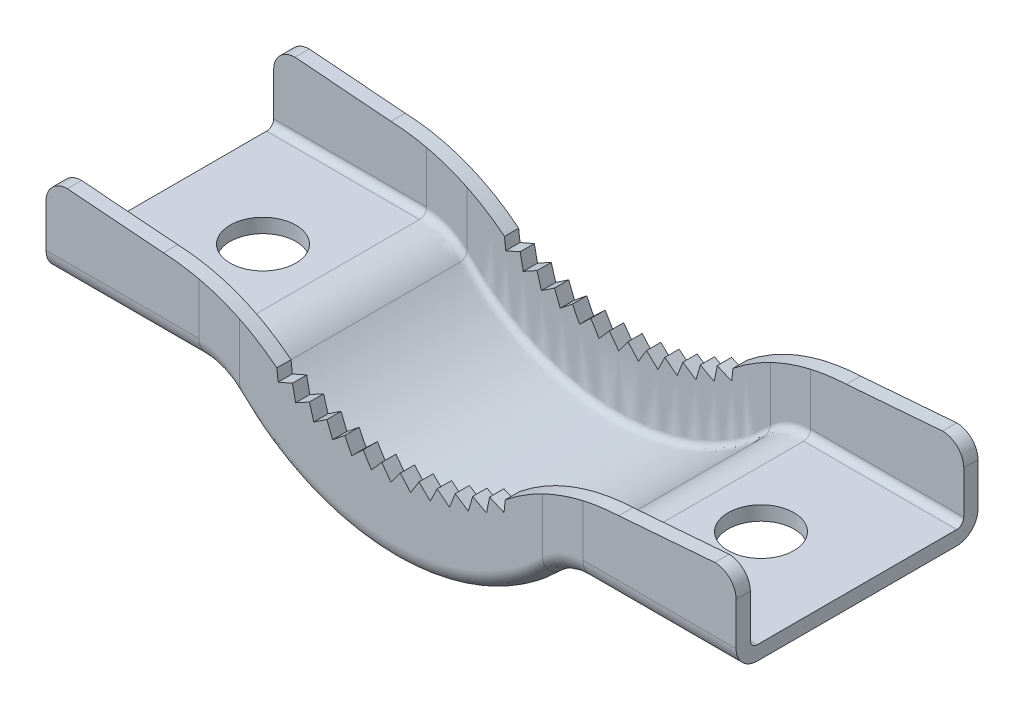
SolidWorks part; units mm, degrees
ref_plane "Plan1" through (0, 0, 0) normal (0, 0, 1) x (1, 0, 0)
ref_plane "Plan2" through (0, 0, 0) normal (0, 1, 0) x (1, 0, 0)
ref_plane "Plan3" through (0, 0, 0) normal (1, 0, 0) x (0, 0, -1)
sketch "Esquisse6" plane through (0, 0, 0) normal (0, 0, 1) x (1, 0, 0)
  line L0 (-26.9896, -18.75) -> (-48.5, -18.75)
  line L1 (0, 40) -> (0, -50) construction
  line L2 (48.5, -18.75) -> (26.9896, -18.75)
  arc A0 (-26.9896, -18.75) -> (-21.3076, -21.1184) centre (-26.9896, -26.75) cw
  arc A1 (21.3076, -21.1184) -> (26.9896, -18.75) centre (26.9896, -26.75) cw
  arc A2 (-21.3076, -21.1184) -> (21.3076, -21.1184) centre (0, 0) ccw
  point P8 (0, -30.75)
  point P9 (-23.4187, -18.75)
  dimension "D2" = 97
  dimension "D3" = 8
  dimension "D4" = 60
  dimension "D1" = 18.75
ref_plane "Plan5" through (-48.5, 0, 0) normal (1, 0, 0) x (0, 0, -1)
sketch "Esquisse7" plane through (-48.5, 0, 0) normal (1, 0, 0) x (0, 0, -1)
  line L0 (20, -18.75) -> (-20, -18.75) construction
  line L1 (-17, -27.75) -> (-17, -18.75)
  line L2 (17, -27.75) -> (17, -18.75)
  line L3 (-14, -30.75) -> (14, -30.75)
  line L4 (17, -18.75) -> (15, -18.75)
  line L5 (0, -13) -> (0, -36) construction
  line L6 (-17, -18.75) -> (-15, -18.75)
  line L7 (15, -18.75) -> (15, -27.75)
  line L8 (14, -28.75) -> (-14, -28.75)
  line L9 (-15, -27.75) -> (-15, -18.75)
  arc A0 (15, -27.75) -> (14, -28.75) centre (14, -27.75) cw
  arc A1 (-14, -28.75) -> (-15, -27.75) centre (-14, -27.75) cw
  arc A2 (-14, -30.75) -> (-17, -27.75) centre (-14, -27.75) cw
  arc A3 (17, -27.75) -> (14, -30.75) centre (14, -27.75) cw
  point P15 (15, -28.75)
  dimension "D5" = 1
  dimension "D6" = 3
  dimension "D1" = 18.75
  dimension "D2" = 12
  dimension "D3" = 2
  dimension "D4" = 10
sweep "Base-Balayage" add profiles "Esquisse7" path "Esquisse6"
fillet "Congé1" radius 3
sketch "Esquisse12" plane through (0, -30.75, 0) normal (0, -1, 0) x (1, 0, 0)
  line L0 (0, 21) -> (0, -19) construction
  line L1 (26.9896, 17) -> (48.5, 17) construction
  circle A0 centre (35, 0) radius 4.625
  circle A1 centre (-35, 0) radius 4.625
  dimension "D1" = 9.25
  dimension "D2" = 35
  dimension "D3" = 17
extrude "Enlèv. mat.-Extru.4" cut sketch "Esquisse12" against normal through all
sketch "Esquisse11" plane through (0, 0, 17) normal (0, 0, 1) x (1, 0, 0)
  line L0 (45.5, -13.7313) -> (-45.5, -13.7313)
  line L1 (-45.5, -13.7313) -> (-45.5, -18.75)
  line L2 (45.5, -13.7313) -> (45.5, -18.75)
  line L3 (16.0585, -25.8456) -> (15.875, -27.4963)
  line L4 (15.875, -27.4963) -> (13.8525, -26.6103)
  line L5 (13.8525, -26.6103) -> (13.4181, -28.7753)
  line L6 (13.4181, -28.7753) -> (11.4805, -27.7164)
  line L7 (11.4805, -27.7164) -> (10.8591, -29.8352)
  line L8 (10.8591, -29.8352) -> (9.0212, -28.6115)
  line L9 (9.0212, -28.6115) -> (8.2175, -30.6681)
  line L10 (8.2175, -30.6681) -> (6.4932, -29.2889)
  line L11 (6.4932, -29.2889) -> (5.5133, -31.2676)
  line L12 (5.5133, -31.2676) -> (3.9158, -29.7433)
  line L13 (3.9158, -29.7433) -> (2.7672, -31.6292)
  line L14 (2.7672, -31.6292) -> (1.3086, -29.9714)
  line L15 (1.3086, -29.9714) -> (0, -31.75)
  line L16 (0, -31.75) -> (-1.3086, -29.9714)
  line L17 (-1.3086, -29.9714) -> (-2.7672, -31.6292)
  line L18 (-2.7672, -31.6292) -> (-3.9158, -29.7433)
  line L19 (-3.9158, -29.7433) -> (-5.5133, -31.2676)
  line L20 (-5.5133, -31.2676) -> (-6.4932, -29.2889)
  line L21 (-6.4932, -29.2889) -> (-8.2175, -30.6681)
  line L22 (-8.2175, -30.6681) -> (-9.0212, -28.6115)
  line L23 (-9.0212, -28.6115) -> (-10.8591, -29.8352)
  line L24 (-10.8591, -29.8352) -> (-11.4805, -27.7164)
  line L25 (-11.4805, -27.7164) -> (-13.4181, -28.7753)
  line L26 (-13.4181, -28.7753) -> (-13.8525, -26.6103)
  line L27 (-13.8525, -26.6103) -> (-15.875, -27.4963)
  line L28 (-15.875, -27.4963) -> (-16.0585, -25.8456)
  line L29 (-45.5, -18.75) -> (-32, -19.8125)
  line L30 (0, 0) -> (0, -46.9154) construction
  line L31 (45.5, -18.75) -> (32, -19.8125)
  arc A0 (16.0585, -25.8456) -> (32, -19.8125) centre (33.1448, -46.9154) cw
  arc A1 (-16.0585, -25.8456) -> (-32, -19.8125) centre (-33.1448, -46.9154) ccw
extrude "Enlèv. mat.-Extru.3" cut sketch "Esquisse11" against normal through all
